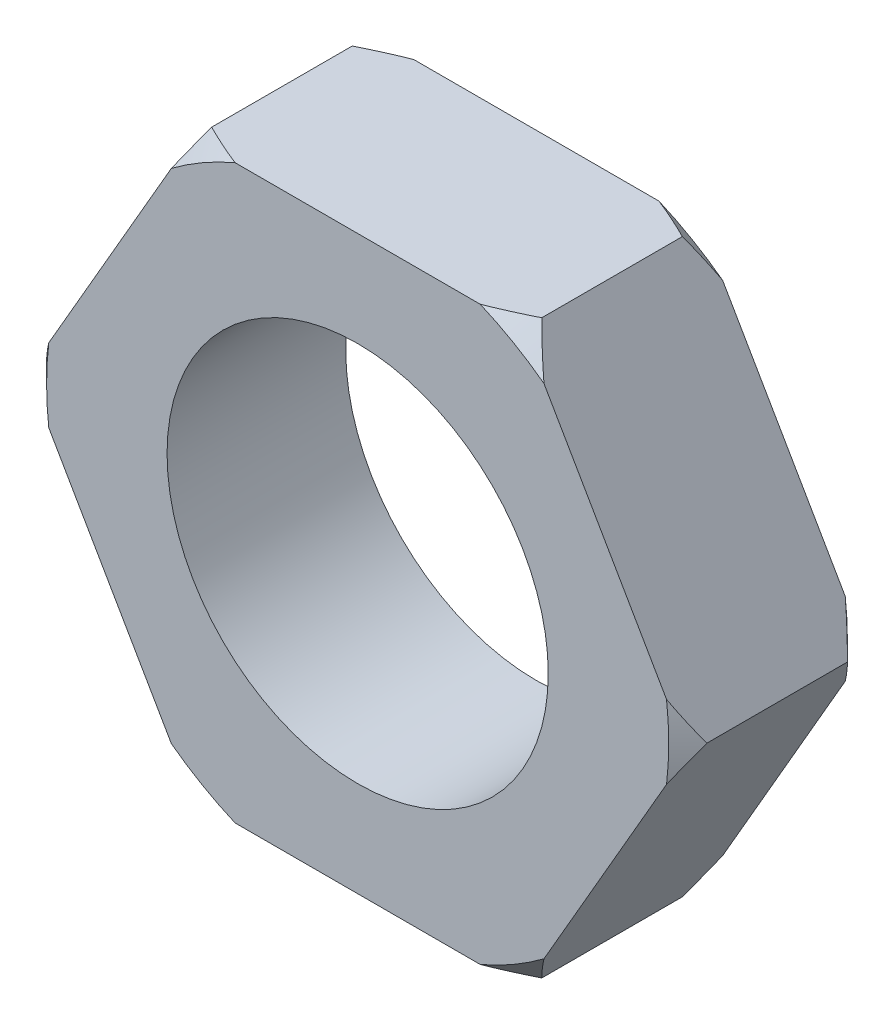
SolidWorks part; units mm, degrees
ref_plane "Face" through (0, 0, 0) normal (0, 0, 1) x (1, 0, 0)
ref_plane "Dessus" through (0, 0, 0) normal (0, 1, 0) x (1, 0, 0)
ref_plane "Droite" through (0, 0, 0) normal (1, 0, 0) x (0, 0, -1)
sketch "Esquisse1" plane through (0, 0, 0) normal (0, 0, 1) x (1, 0, 0)
  line L1 (-6.9282, 12) -> (-13.8564, 0)
  line L2 (-13.8564, 0) -> (-6.9282, -12)
  line L3 (-6.9282, -12) -> (6.9282, -12)
  line L4 (6.9282, -12) -> (13.8564, 0)
  line L5 (13.8564, 0) -> (6.9282, 12)
  line L6 (6.9282, 12) -> (-6.9282, 12)
  circle A0 centre (0, 0) radius 12 construction
  circle A1 centre (0, 0) radius 8
  dimension "D1" = 24
  dimension "D2" = 16
extrude "Base-Extrusion" add sketch "Esquisse1" against normal blind 7.5
sketch "Esquisse2" plane through (0, 0, 0) normal (0, 1, 0) x (1, 0, 0)
  line L0 (0, 8.9316) -> (0, -2.935) construction
  line L1 (0, 7.5) -> (0, 0) construction
  line L2 (-13.8564, 7.5) -> (-13.0564, 7.5)
  line L3 (-13.0564, 7.5) -> (-13.8564, 6.7)
  line L4 (-13.8564, 7.5) -> (-13.8564, 0) construction
  line L5 (-13.8564, 6.7) -> (-13.8564, 7.5)
  line L6 (-13.8564, 0) -> (-13.0564, 0)
  line L7 (-6.9282, 0) -> (-13.8564, 0) construction
  line L8 (-13.0564, 0) -> (-13.8564, 0.8)
  line L9 (-13.8564, 0.8) -> (-13.8564, 0)
  dimension "D1" = 0.8
  dimension "D2" = 0.8
revolve "Enlèvement de matière-Révolution1" cut sketch "Esquisse2" angle 360 about L0
